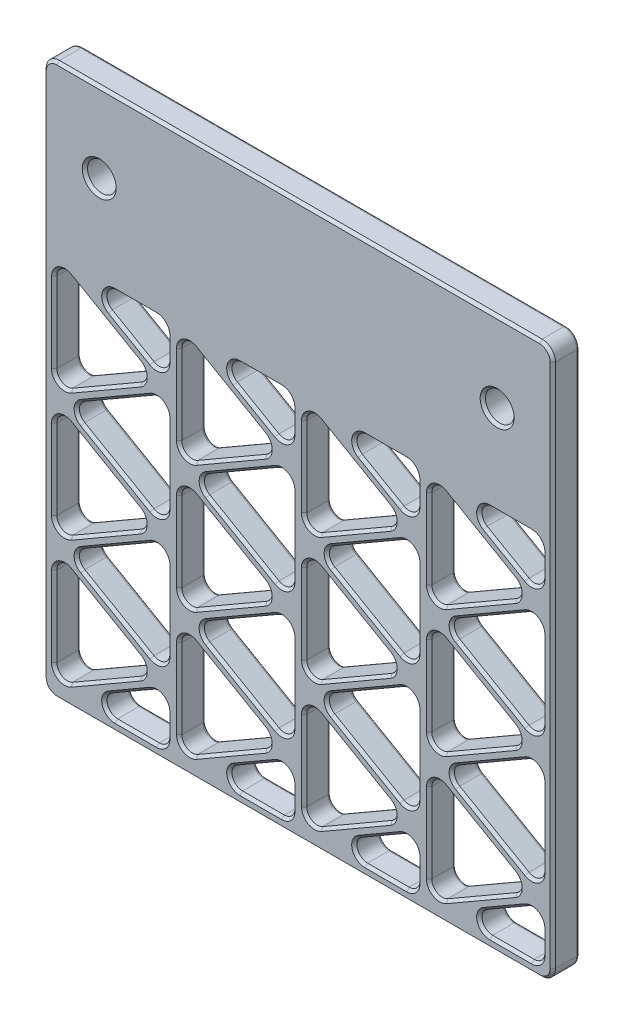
SolidWorks part; units mm, degrees
ref_plane "Płaszczyzna przednia" through (0, 0, 0) normal (0, 0, 1) x (1, 0, 0)
ref_plane "Płaszczyzna górna" through (0, 0, 0) normal (0, 1, 0) x (1, 0, 0)
ref_plane "Płaszczyzna prawa" through (0, 0, 0) normal (1, 0, 0) x (0, 0, -1)
sketch "Szkic1" plane through (0, 0, 0) normal (0, 0, 1) x (1, 0, 0)
  line L1 (0, 0) -> (96, 0)
  line L2 (0, 0) -> (0, 104)
  line L3 (0, 104) -> (96, 104)
  line L4 (96, 0) -> (96, 104)
  dimension "D1" = 96
  dimension "D2" = 104
extrude "Dodanie-wyciągnięcie1" add sketch "Szkic1" along normal blind 5
sketch "Szkic3" plane through (0, 0, 5) normal (0, 0, 1) x (1, 0, 0)
  line L0 (0, 74) -> (96, 74) construction
  line L1 (0, 104) -> (0, 0) construction
  line L2 (96, 0) -> (96, 104) construction
  line L3 (96, 104) -> (0, 104) construction
  line L4 (10.5, 89) -> (85.5, 89) construction
  line L5 (48, 89) -> (48, 104) construction
  line L6 (2, 72) -> (2, 50)
  line L7 (2, 50) -> (21.0526, 61)
  line L8 (21.0526, 61) -> (2, 72)
  line L9 (0, 49) -> (102.6705, 49) construction
  line L10 (21.0526, 37) -> (2, 26)
  line L11 (2, 48) -> (21.0526, 37)
  line L12 (2, 26) -> (2, 48)
  line L13 (0, 25) -> (96, 25) construction
  line L14 (2, 24) -> (2, 2)
  line L15 (2, 2) -> (21.0526, 13)
  line L16 (21.0526, 13) -> (2, 24)
  line L17 (6, 72) -> (23.3205, 62)
  line L18 (23.3205, 62) -> (23.3205, 72)
  line L19 (23.3205, 72) -> (6, 72)
  line L20 (23.3205, 60) -> (4.2679, 49)
  line L21 (4.2679, 49) -> (23.3205, 38)
  line L22 (23.3205, 38) -> (23.3205, 60)
  line L23 (21.0526, 37) -> (30.5501, 37) construction
  line L24 (23.3205, 14) -> (4.2679, 25)
  line L25 (4.2679, 25) -> (23.3205, 36)
  line L26 (23.3205, 36) -> (23.3205, 14)
  line L27 (6, 2) -> (23.3205, 12)
  line L28 (23.3205, 2) -> (6, 2)
  line L29 (23.3205, 12) -> (23.3205, 2)
  line L30 (25.5598, 72) -> (25.5598, 50)
  line L31 (25.5598, 50) -> (44.6124, 61)
  line L32 (44.6124, 61) -> (25.5598, 72)
  line L33 (44.6124, 37) -> (25.5598, 26)
  line L34 (25.5598, 48) -> (44.6124, 37)
  line L35 (25.5598, 26) -> (25.5598, 48)
  line L36 (25.5598, 24) -> (25.5598, 2)
  line L37 (25.5598, 2) -> (44.6124, 13)
  line L38 (44.6124, 13) -> (25.5598, 24)
  line L39 (29.5598, 72) -> (46.8803, 62)
  line L40 (46.8803, 62) -> (46.8803, 72)
  line L41 (46.8803, 72) -> (29.5598, 72)
  line L42 (46.8803, 60) -> (27.8278, 49)
  line L43 (27.8278, 49) -> (46.8803, 38)
  line L44 (46.8803, 38) -> (46.8803, 60)
  line L45 (46.8803, 14) -> (27.8278, 25)
  line L46 (27.8278, 25) -> (46.8803, 36)
  line L47 (46.8803, 36) -> (46.8803, 14)
  line L48 (29.5598, 2) -> (46.8803, 12)
  line L49 (46.8803, 2) -> (29.5598, 2)
  line L50 (46.8803, 12) -> (46.8803, 2)
  line L51 (49.1197, 72) -> (49.1197, 50)
  line L52 (49.1197, 50) -> (68.1722, 61)
  line L53 (68.1722, 61) -> (49.1197, 72)
  line L54 (68.1722, 37) -> (49.1197, 26)
  line L55 (49.1197, 48) -> (68.1722, 37)
  line L56 (49.1197, 26) -> (49.1197, 48)
  line L57 (49.1197, 24) -> (49.1197, 2)
  line L58 (49.1197, 2) -> (68.1722, 13)
  line L59 (68.1722, 13) -> (49.1197, 24)
  line L60 (53.1197, 72) -> (70.4402, 62)
  line L61 (70.4402, 62) -> (70.4402, 72)
  line L62 (70.4402, 72) -> (53.1197, 72)
  line L63 (70.4402, 60) -> (51.3876, 49)
  line L64 (51.3876, 49) -> (70.4402, 38)
  line L65 (70.4402, 38) -> (70.4402, 60)
  line L66 (70.4402, 14) -> (51.3876, 25)
  line L67 (51.3876, 25) -> (70.4402, 36)
  line L68 (70.4402, 36) -> (70.4402, 14)
  line L69 (53.1197, 2) -> (70.4402, 12)
  line L70 (70.4402, 2) -> (53.1197, 2)
  line L71 (70.4402, 12) -> (70.4402, 2)
  line L72 (72.6795, 72) -> (72.6795, 50)
  line L73 (72.6795, 50) -> (91.7321, 61)
  line L74 (91.7321, 61) -> (72.6795, 72)
  line L75 (91.7321, 37) -> (72.6795, 26)
  line L76 (72.6795, 48) -> (91.7321, 37)
  line L77 (72.6795, 26) -> (72.6795, 48)
  line L78 (72.6795, 24) -> (72.6795, 2)
  line L79 (72.6795, 2) -> (91.7321, 13)
  line L80 (91.7321, 13) -> (72.6795, 24)
  line L81 (76.6795, 72) -> (94, 62)
  line L82 (94, 62) -> (94, 72)
  line L83 (94, 72) -> (76.6795, 72)
  line L84 (94, 60) -> (74.9474, 49)
  line L85 (74.9474, 49) -> (94, 38)
  line L86 (94, 38) -> (94, 60)
  line L87 (94, 14) -> (74.9474, 25)
  line L88 (74.9474, 25) -> (94, 36)
  line L89 (94, 36) -> (94, 14)
  line L90 (76.6795, 2) -> (94, 12)
  line L91 (94, 2) -> (76.6795, 2)
  line L92 (94, 12) -> (94, 2)
  circle A0 centre (10.5, 89) radius 2.7
  circle A1 centre (85.5, 89) radius 2.7
  dimension "D4" = 5.4
  dimension "D1" = 30
  dimension "D2" = 75
  dimension "D3" = 15
  dimension "D5" = 2
  dimension "D6" = 2
  dimension "D7" = 22
  dimension "D8" = 2
  dimension "D9" = 2
  dimension "D10" = 2
  dimension "D11" = 2
  dimension "D12" = 2
  dimension "D13" = 2
  dimension "D15" = 2
  dimension "D14" = 4
extrude "Wytnij-wyciągnięcie1" cut sketch "Szkic3" against normal through all
fillet "Zaokrąglenie1" radius 2.5 4 edges at (0, 0, 2.5) (96, 0, 2.5) (96, 104, 2.5) (0, 104, 2.5)
fillet "Zaokrąglenie2" radius 2 16 edges at (23.3205, 12, 2.5) (46.8803, 12, 2.5) (70.4402, 12, 2.5) (94, 12, 2.5) (94, 36, 2.5) (70.4402, 36, 2.5) (46.8803, 36, 2.5) (23.3205, 36, 2.5) (23.3205, 60, 2.5) (46.8803, 60, 2.5) (70.4402, 60, 2.5) (94, 60, 2.5) (94, 72, 2.5) (70.4402, 72, 2.5) (46.8803, 72, 2.5) (23.3205, 72, 2.5)
fillet "Zaokrąglenie3" radius 2 16 edges at (76.6795, 2, 2.5) (53.1197, 2, 2.5) (29.5598, 2, 2.5) (6, 2, 2.5) (4.2679, 49, 2.5) (51.3876, 49, 2.5) (74.9474, 25, 2.5) (51.3876, 25, 2.5) (27.8278, 25, 2.5) (4.2679, 25, 2.5) (27.8278, 49, 2.5) (74.9474, 49, 2.5) (76.6795, 72, 2.5) (53.1197, 72, 2.5) (29.5598, 72, 2.5) (6, 72, 2.5)
fillet "Zaokrąglenie4" radius 2 23 edges at (49.1197, 2, 2.5) (72.6795, 2, 2.5) (72.6795, 26, 2.5) (72.6795, 50, 2.5) (49.1197, 26, 2.5) (25.5598, 2, 2.5) (2, 2, 2.5) (49.1197, 50, 2.5) (25.5598, 50, 2.5) (2, 50, 2.5) (2, 26, 2.5) (72.6795, 24, 2.5) (49.1197, 24, 2.5) (25.5598, 24, 2.5) (2, 24, 2.5) (2, 48, 2.5) (25.5598, 48, 2.5) (49.1197, 48, 2.5) (72.6795, 48, 2.5) (72.6795, 72, 2.5) (49.1197, 72, 2.5) (25.5598, 72, 2.5) (2, 72, 2.5)
fillet "Zaokrąglenie5" radius 2 29 edges at (25.5598, 26, 2.5) (91.7321, 61, 2.5) (68.1722, 61, 2.5) (44.6124, 61, 2.5) (21.0526, 61, 2.5) (91.7321, 37, 2.5) (68.1722, 37, 2.5) (21.0526, 37, 2.5) (44.6124, 37, 2.5) (21.0526, 13, 2.5) (44.6124, 13, 2.5) (68.1722, 13, 2.5) (23.3205, 2, 2.5) (23.3205, 14, 2.5) (23.3205, 38, 2.5) (23.3205, 62, 2.5) (46.8803, 62, 2.5) (70.4402, 62, 2.5) (46.8803, 2, 2.5) (46.8803, 38, 2.5) (94, 2, 2.5) (70.4402, 2, 2.5) (70.4402, 14, 2.5) (46.8803, 14, 2.5) (70.4402, 38, 2.5) (94, 62, 2.5) (94, 38, 2.5) (94, 14, 2.5) (91.7321, 13, 2.5)
fillet "Zaokrąglenie6" radius 0.5 110 edges at (95.2678, 103.2678, 0) (0.7322, 103.2678, 0) (0, 52, 0) (0.7322, 0.7322, 0) (48, 0, 0) (73.6795, 27.7321, 0) (72.6795, 37, 0) (73.6795, 46.2679, 0) (82.2058, 42.5, 0) (82.2058, 31.5, 0) (73.6795, 51.7321, 0) (72.6795, 61, 0) (82.2058, 66.5, 0) (89.7321, 61, 0) (70.4402, 6.2679, 0) (58.6519, 3.4824, 0) (63.512, 8, 0) (69.4402, 58.2679, 0) (70.4402, 49, 0) (69.4402, 39.7321, 0) (50.1197, 27.7321, 0) (49.1197, 37, 0) (58.6459, 42.5, 0) (66.1722, 37, 0) (58.6459, 31.5, 0) (50.1197, 3.7321, 0) (49.1197, 13, 0) (58.6459, 18.5, 0) (66.1722, 13, 0) (69.8544, 71.4142, 0) (70.4402, 67.7321, 0) (69.4402, 63.7321, 0) (69.4402, 34.2679, 0) (70.4402, 25, 0) (69.4402, 15.7321, 0) (93, 10.2679, 0) (88.0718, 2, 0) (82.2117, 3.4824, 0) (87.0718, 8, 0) (73.6795, 3.7321, 0) (72.6795, 13, 0) (82.2058, 18.5, 0) (89.7321, 13, 0) (82.2117, 70.5176, 0) (88.0718, 72, 0) (76.9474, 25, 0) (84.4737, 30.5, 0) (93, 34.2679, 0) (94, 25, 0) (93, 15.7321, 0) (84.4737, 54.5, 0) (93, 58.2679, 0) (93, 39.7321, 0) (22.7347, 71.4142, 0) (23.3205, 67.7321, 0) (6.2679, 25, 0) (22.3205, 34.2679, 0) (22.3205, 15.7321, 0) (13.7942, 19.5, 0) (6.2679, 49, 0) (22.3205, 58.2679, 0) (23.3205, 49, 0) (13.7942, 43.5, 0) (22.3205, 10.2679, 0) (22.7347, 2.5858, 0) (17.3923, 2, 0) (11.5322, 3.4824, 0) (3, 3.7321, 0) (2, 13, 0) (3, 22.2679, 0) (11.5263, 18.5, 0) (11.5263, 7.5, 0) (3, 27.7321, 0) (11.5263, 42.5, 0) (19.0526, 37, 0) (3, 51.7321, 0) (2, 61, 0) (19.0526, 61, 0) (11.5263, 55.5, 0) (88.2, 89, 0) (37.3541, 30.5, 0) (45.8803, 34.2679, 0) (45.8803, 15.7321, 0) (37.3541, 19.5, 0) (29.8278, 49, 0) (37.3541, 54.5, 0) (45.8803, 58.2679, 0) (46.8803, 49, 0) (45.8803, 39.7321, 0) (37.3541, 43.5, 0) (45.8803, 10.2679, 0) (46.8803, 6.2679, 0) (46.2946, 2.5858, 0) (40.9521, 2, 0) (35.0921, 3.4824, 0) (39.9521, 8, 0) (50.1197, 51.7321, 0) (66.1722, 61, 0) (25.5598, 61, 0) (35.0861, 66.5, 0) (35.0861, 55.5, 0) (26.5598, 27.7321, 0) (26.5598, 46.2679, 0) (35.0861, 42.5, 0) (42.6124, 37, 0) (26.5598, 3.7321, 0) (26.5598, 22.2679, 0) (35.0861, 7.5, 0) (40.9521, 72, 0) (46.8803, 67.7321, 0)
chamfer "Sfazowanie1" distance 0.5 angle 45 178 edges at (0.7322, 103.2678, 5) (48, 104, 5) (95.2678, 103.2678, 5) (96, 52, 5) (95.2678, 0.7322, 5) (48, 0, 5) (0.7322, 0.7322, 5) (0, 52, 5) (13.2, 89, 5) (73.6795, 27.7321, 5) (82.2058, 31.5, 5) (89.7321, 37, 5) (82.2058, 42.5, 5) (73.6795, 46.2679, 5) (72.6795, 37, 5) (73.6795, 51.7321, 5) (82.2058, 55.5, 5) (89.7321, 61, 5) (82.2058, 66.5, 5) (73.6795, 70.2679, 5) (72.6795, 61, 5) (69.4402, 10.2679, 5) (63.512, 8, 5) (58.6519, 3.4824, 5) (64.512, 2, 5) (69.8544, 2.5858, 5) (70.4402, 6.2679, 5) (53.3876, 49, 5) (60.9139, 43.5, 5) (69.4402, 39.7321, 5) (70.4402, 49, 5) (69.4402, 58.2679, 5) (60.9139, 54.5, 5) (50.1197, 27.7321, 5) (58.6459, 31.5, 5) (66.1722, 37, 5) (58.6459, 42.5, 5) (50.1197, 46.2679, 5) (49.1197, 37, 5) (50.1197, 3.7321, 5) (58.6459, 7.5, 5) (66.1722, 13, 5) (58.6459, 18.5, 5) (50.1197, 22.2679, 5) (49.1197, 13, 5) (69.4402, 63.7321, 5) (70.4402, 67.7321, 5) (69.8544, 71.4142, 5) (64.512, 72, 5) (58.6519, 70.5176, 5) (63.512, 66, 5) (53.3876, 25, 5) (60.9139, 19.5, 5) (69.4402, 15.7321, 5) (70.4402, 25, 5) (69.4402, 34.2679, 5) (60.9139, 30.5, 5) (93, 10.2679, 5) (87.0718, 8, 5) (82.2117, 3.4824, 5) (88.0718, 2, 5) (93.4142, 2.5858, 5) (94, 6.2679, 5) (73.6795, 3.7321, 5) (82.2058, 7.5, 5) (89.7321, 13, 5) (82.2058, 18.5, 5) (73.6795, 22.2679, 5) (72.6795, 13, 5) (93, 63.7321, 5) (94, 67.7321, 5) (93.4142, 71.4142, 5) (88.0718, 72, 5) (82.2117, 70.5176, 5) (87.0718, 66, 5) (76.9474, 25, 5) (84.4737, 19.5, 5) (93, 15.7321, 5) (94, 25, 5) (93, 34.2679, 5) (84.4737, 30.5, 5) (76.9474, 49, 5) (84.4737, 43.5, 5) (93, 39.7321, 5) (94, 49, 5) (93, 58.2679, 5) (84.4737, 54.5, 5) (22.3205, 63.7321, 5) (23.3205, 67.7321, 5) (22.7347, 71.4142, 5) (17.3923, 72, 5) (11.5322, 70.5176, 5) (16.3923, 66, 5) (6.2679, 25, 5) (13.7942, 19.5, 5) (22.3205, 15.7321, 5) (23.3205, 25, 5) (22.3205, 34.2679, 5) (13.7942, 30.5, 5) (6.2679, 49, 5) (13.7942, 43.5, 5) (22.3205, 39.7321, 5) (23.3205, 49, 5) (22.3205, 58.2679, 5) (13.7942, 54.5, 5) (22.3205, 10.2679, 5) (16.3923, 8, 5) (11.5322, 3.4824, 5) (17.3923, 2, 5) (22.7347, 2.5858, 5) (23.3205, 6.2679, 5) (3, 3.7321, 5) (11.5263, 7.5, 5) (19.0526, 13, 5) (11.5263, 18.5, 5) (3, 22.2679, 5) (2, 13, 5) (3, 27.7321, 5) (11.5263, 31.5, 5) (19.0526, 37, 5) (11.5263, 42.5, 5) (3, 46.2679, 5) (2, 37, 5) (3, 51.7321, 5) (11.5263, 55.5, 5) (19.0526, 61, 5) (11.5263, 66.5, 5) (3, 70.2679, 5) (2, 61, 5) (88.2, 89, 5) (29.8278, 25, 5) (37.3541, 19.5, 5) (45.8803, 15.7321, 5) (46.8803, 25, 5) (45.8803, 34.2679, 5) (37.3541, 30.5, 5) (29.8278, 49, 5) (37.3541, 43.5, 5) (45.8803, 39.7321, 5) (46.8803, 49, 5) (45.8803, 58.2679, 5) (37.3541, 54.5, 5) (45.8803, 10.2679, 5) (39.9521, 8, 5) (35.0921, 3.4824, 5) (40.9521, 2, 5) (46.2946, 2.5858, 5) (46.8803, 6.2679, 5) (50.1197, 51.7321, 5) (58.6459, 55.5, 5) (66.1722, 61, 5) (58.6459, 66.5, 5) (50.1197, 70.2679, 5) (49.1197, 61, 5) (26.5598, 51.7321, 5) (35.0861, 55.5, 5) (42.6124, 61, 5) (35.0861, 66.5, 5) (26.5598, 70.2679, 5) (25.5598, 61, 5) (26.5598, 27.7321, 5) (35.0861, 31.5, 5) (42.6124, 37, 5) (35.0861, 42.5, 5) (26.5598, 46.2679, 5) (25.5598, 37, 5) (26.5598, 3.7321, 5) (35.0861, 7.5, 5) (42.6124, 13, 5) (35.0861, 18.5, 5) (26.5598, 22.2679, 5) (25.5598, 13, 5) (45.8803, 63.7321, 5) (46.8803, 67.7321, 5) (46.2946, 71.4142, 5) (40.9521, 72, 5) (35.0921, 70.5176, 5) (39.9521, 66, 5)
